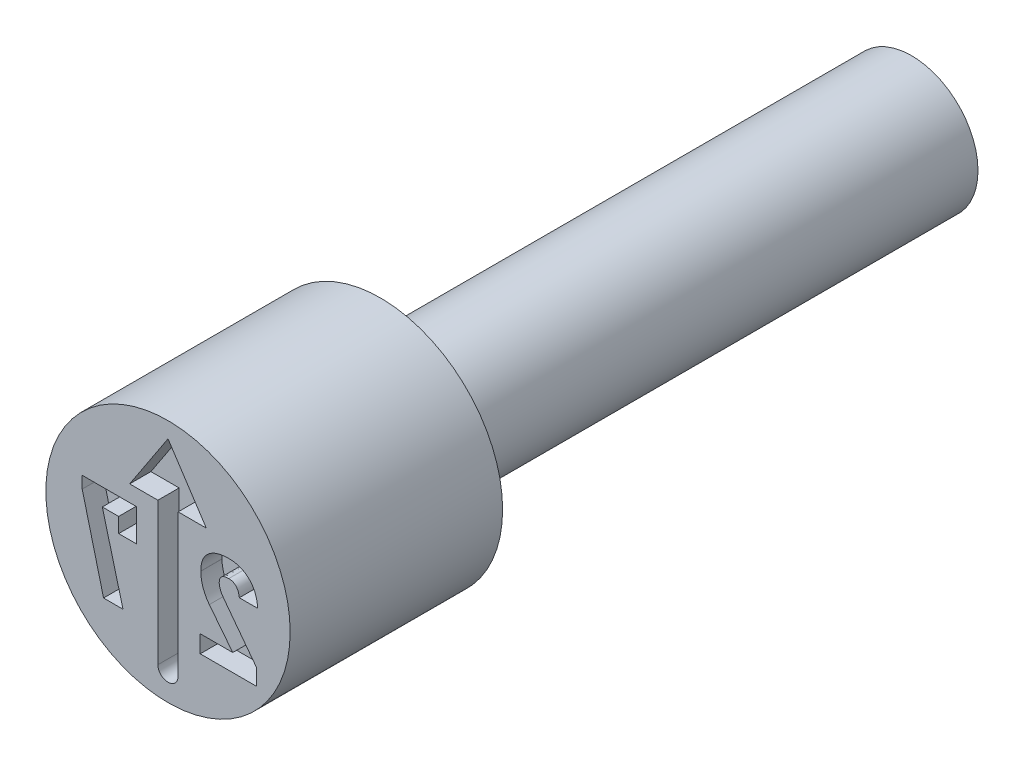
SolidWorks part; units mm, degrees
ref_plane "Front Plane" through (0, 0, 0) normal (0, 0, 1) x (1, 0, 0)
ref_plane "Top Plane" through (0, 0, 0) normal (0, 1, 0) x (1, 0, 0)
ref_plane "Right Plane" through (0, 0, 0) normal (1, 0, 0) x (0, 0, -1)
sketch "Sketch2" plane through (0, 0, 0) normal (1, 0, 0) x (0, 0, -1)
  line L0 (0.4039, 0) -> (50000.4039, 0) construction
  line L6 (0, 2.3) -> (0, 0)
  line L7 (4, 2.3) -> (0, 2.3)
  line L8 (4, 1.25) -> (4, 2.3)
  line L9 (14, 1.25) -> (4, 1.25)
  line L10 (14, 0) -> (14, 1.25)
  line L11 (0, 0) -> (14, 0)
  dimension "D1" = 4.6
  dimension "D2" = 2.5
  dimension "D3" = 14
  dimension "D4" = 4
revolve "Revolve1" add sketch "Sketch2" angle 360 about L0
sketch "Sketch3" plane through (0, 0, 0) normal (0, 0, 1) x (1, 0, 0)
  line L0 (0, 0) -> (0, 100000) construction
  line L1 (0.1905, 0.9064) -> (0.1905, -1.7762)
  line L2 (0.7219, 0.9064) -> (0.1905, 0.9064)
  line L3 (0, 2.0021) -> (0.7219, 0.9064)
  line L15 (0, 2.0021) -> (-0.7219, 0.9064)
  line L16 (-0.7219, 0.9064) -> (-0.1905, 0.9064)
  line L17 (-0.1905, 0.9064) -> (-0.1905, -1.7762)
  arc A2 (-0.1905, -1.7762) -> (0.1905, -1.7762) centre (0, -1.7762) ccw
extrude "Cut-Extrude4" cut sketch "Sketch3" against normal blind 0.4
sketch "Sketch4" plane through (0, 0, 0) normal (0, 0, 1) x (1, 0, 0)
  text T0 "2  7" font "Bahnschrift" height 1.8
  dimension "D1" = 1.2
  dimension "D2" = 1.8
extrude "Cut-Extrude5" cut sketch "Sketch4" against normal blind 0.4
